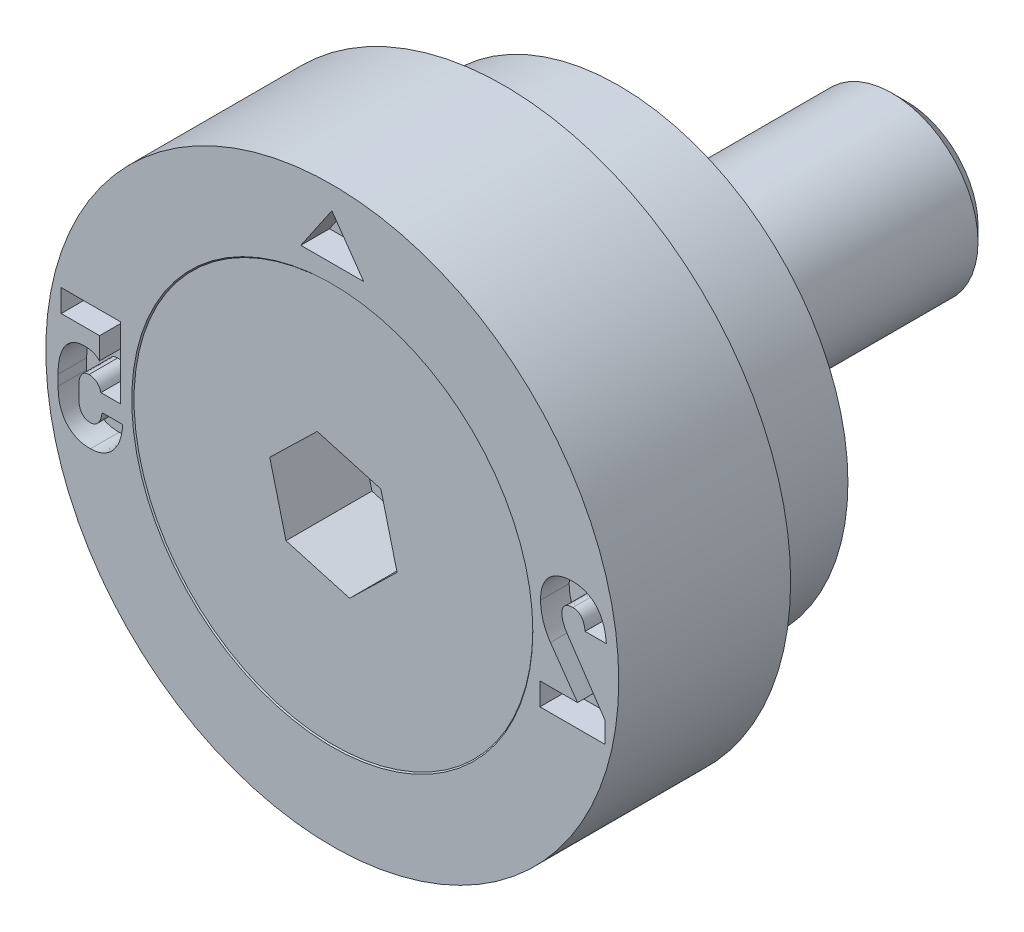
SolidWorks part; units mm, degrees
other "<M3 X .5 FHCS>-<Imported1>"
ref_plane "Front Plane" through (0, 0, 0) normal (0, 0, 1) x (1, 0, 0)
ref_plane "Top Plane" through (0, 0, 0) normal (0, 1, 0) x (1, 0, 0)
ref_plane "Right Plane" through (0, 0, 0) normal (1, 0, 0) x (0, 0, -1)
imported_body "Imported1"
sketch "Sketch1" plane through (0, 0, 0) normal (0, 0, 1) x (1, 0, 0)
  text T0 "2          5" font "Bahnschrift" height 2.159
  dimension "D1" = 1.0795
  dimension "D2" = 4.9022
extrude "Cut-Extrude1" cut sketch "Sketch1" against normal blind 0.5
inserted part "M3 X .5 FHCS"
move or copy body "Body-Move/Copy2" placed by mates yes
